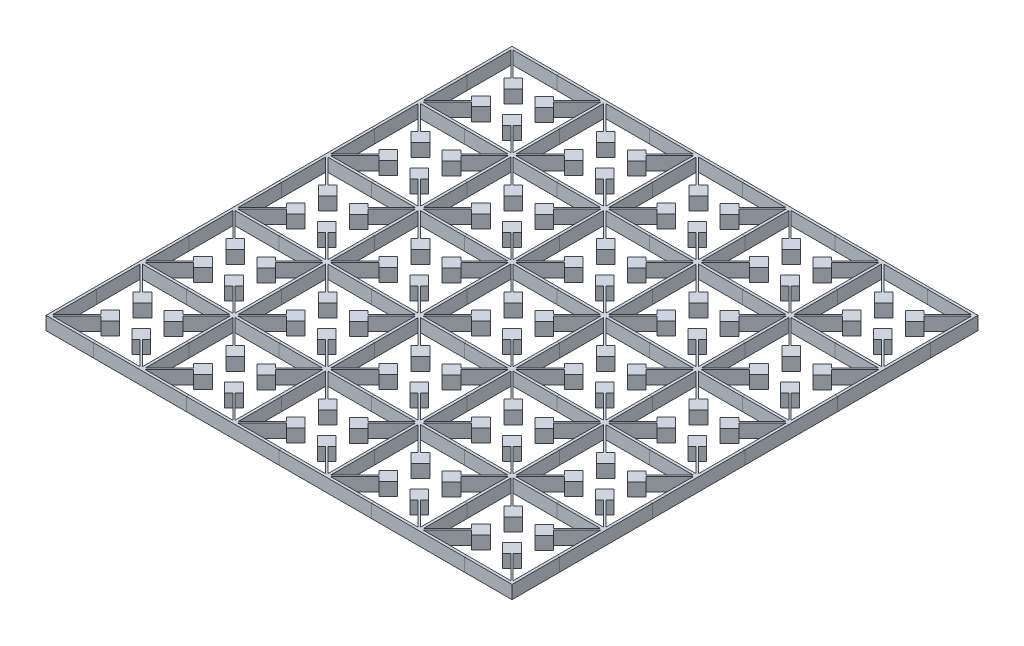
SolidWorks part; units mm, degrees
ref_plane "Front Plane" through (0, 0, 0) normal (0, 0, 1) x (1, 0, 0)
ref_plane "Top Plane" through (0, 0, 0) normal (0, 1, 0) x (1, 0, 0)
ref_plane "Right Plane" through (0, 0, 0) normal (1, 0, 0) x (0, 0, -1)
other "Center of Mass"
sketch "Sketch1" plane through (0, 0, 0) normal (0, 1, 0) x (1, 0, 0)
  line L0 (-17.5, 0) -> (17.5, 0)
  line L1 (0, 17.5) -> (0, -17.5)
  point P7 (0, 0)
  dimension "D1" = 35
  dimension "D2" = 35
  dimension "D3" = 17.5
  dimension "D4" = 17.5
extrude "Extrude-Thin1" add sketch "Sketch1" along normal blind 5 thin
sketch "Sketch3" plane through (0, 0, 0) normal (0, 1, 0) x (1, 0, 0)
  line L0 (-9.8854, 9.8854) -> (9.8854, -9.8854)
  line L1 (-9.8854, -9.8854) -> (9.8854, 9.8854)
  line L2 (-2.75, 0) -> (2.75, 0) construction
  dimension "D1" = 27.96
  dimension "D2" = 27.96
  dimension "D3" = 45
  dimension "D4" = 45
extrude "Extrude-Thin2" add sketch "Sketch3" along normal blind 5 thin
sketch "Sketch4" plane through (0, 0, 0) normal (0, -1, 0) x (1, 0, 0)
  line L0 (8.3403, 11.4304) -> (11.8759, 14.9659)
  line L1 (11.8759, 14.9659) -> (15.4114, 11.4304)
  line L2 (15.4114, 11.4304) -> (11.8759, 7.8948)
  line L3 (11.8759, 7.8948) -> (8.3403, 11.4304)
  line L4 (10.1081, 9.6626) -> (9.6626, 10.1081) construction
  line L5 (0.9455, 0.5) -> (10.1081, 9.6626) construction
  line L6 (11.6531, -8.1176) -> (15.1887, -11.6531)
  line L7 (15.1887, -11.6531) -> (11.6531, -15.1887)
  line L8 (11.6531, -15.1887) -> (8.1176, -11.6531)
  line L9 (8.1176, -11.6531) -> (11.6531, -8.1176)
  line L10 (-7.8948, -11.4304) -> (-11.4304, -14.9659)
  line L11 (-11.4304, -14.9659) -> (-14.9659, -11.4304)
  line L12 (-14.9659, -11.4304) -> (-11.4304, -7.8948)
  line L13 (-11.4304, -7.8948) -> (-7.8948, -11.4304)
  line L14 (-11.2076, 8.1176) -> (-14.7432, 11.6531)
  line L15 (-14.7432, 11.6531) -> (-11.2076, 15.1887)
  line L16 (-11.2076, 15.1887) -> (-7.6721, 11.6531)
  line L17 (-7.6721, 11.6531) -> (-11.2076, 8.1176)
  dimension "D1" = 5
  dimension "D2" = 5
  dimension "D3" = 2.5
  dimension "D4" = 4
extrude "Boss-Extrude2" add sketch "Sketch4" against normal blind 5
pattern_linear "LPattern1" count 2 spacing 35 along (-1, 0, 0) count 2 spacing 35 along (0, 0, -1)
pattern_linear "LPattern2" count 5 spacing 35 along (1, 0, 0) count 5 spacing 35 along (0, 0, 1)
pattern_linear "LPattern3" count 5 spacing 35 along (1, 0, 0)
pattern_linear "LPattern4" count 5 spacing 35 along (0, 0, 1)
sketch "Sketch6" plane through (0, 0, 0) normal (0, 1, 0) x (1, 0, 0)
  line L0 (-35.5, 35.5) -> (140.5, 35.5)
  line L1 (140.5, 35.5) -> (140.5, -140.5)
  line L2 (140.5, -140.5) -> (-35.5, -140.5)
  line L3 (-35.5, -140.5) -> (-35.5, 35.5)
  line L4 (140.5, -105.9455) -> (140.5, -122.5) construction
  line L5 (-34.0545, 35.5) -> (-17.5, 35.5) construction
  line L6 (-35.5, 34.0545) -> (-35.5, 17.5) construction
  line L7 (105.9455, -140.5) -> (122.5, -140.5) construction
extrude "Cut-Extrude1" cut sketch "Sketch6" along direction (0, -1, 0) on the side of the normal blind 485 flip side to cut contours L0 L1 L2 L3
